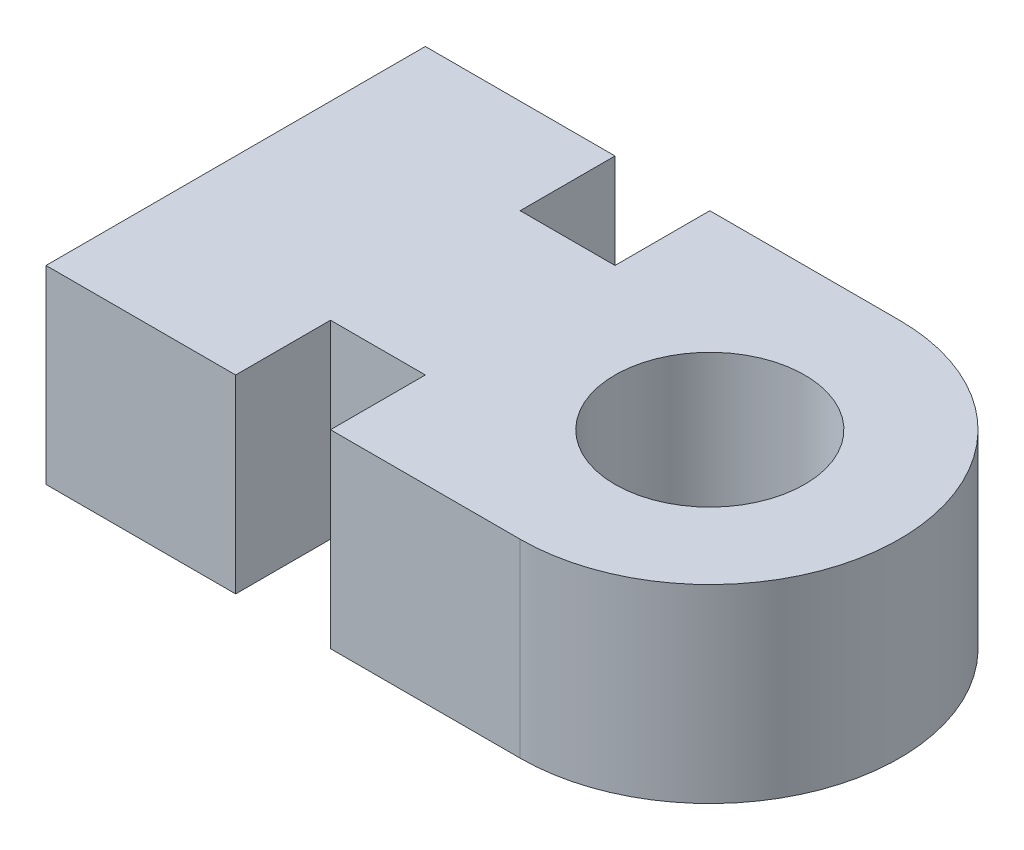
SolidWorks part; units mm, degrees
ref_plane "Front Plane" through (0, 0, 0) normal (0, 0, 1) x (1, 0, 0)
ref_plane "Top Plane" through (0, 0, 0) normal (0, 1, 0) x (1, 0, 0)
ref_plane "Right Plane" through (0, 0, 0) normal (1, 0, 0) x (0, 0, -1)
sketch "Sketch1" plane through (0, 0, 0) normal (0, 1, 0) x (1, 0, 0)
  line L0 (0, 20) -> (-20, 20)
  line L1 (-20, 20) -> (-20, 10)
  line L2 (-20, 10) -> (-30, 10)
  line L3 (-30, 10) -> (-30, 20)
  line L4 (-30, 20) -> (-50, 20)
  line L5 (-50, 20) -> (-50, -20)
  line L6 (0, 0) -> (-57.5574, 0) construction
  line L7 (-30, -20) -> (-50, -20)
  line L8 (-30, -10) -> (-30, -20)
  line L9 (-20, -10) -> (-30, -10)
  line L10 (-20, -20) -> (-20, -10)
  line L11 (0, -20) -> (-20, -20)
  circle A0 centre (0, 0) radius 10
  arc A1 (0, -20) -> (0, 20) centre (0, 0) ccw
  point P13 (-50, 0)
  dimension "D1" = 20
  dimension "D2" = 40
  dimension "D3" = 20
  dimension "D4" = 10
  dimension "D5" = 10
  dimension "D6" = 50
extrude "Extrude1" add sketch "Sketch1" along normal mid plane 20
